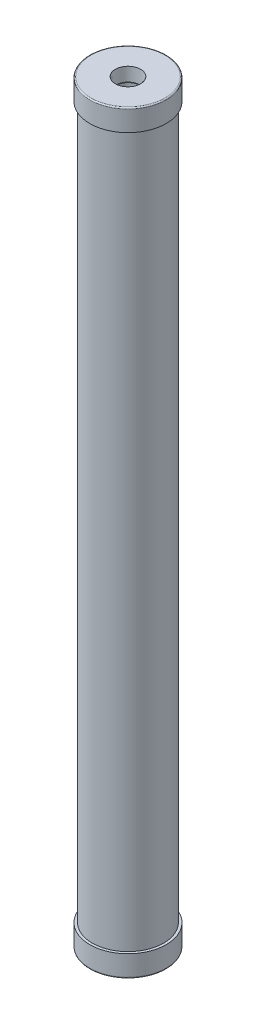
SolidWorks part; units mm, degrees
ref_plane "Front Plane" through (0, 0, 0) normal (0, 0, 1) x (1, 0, 0)
ref_plane "Top Plane" through (0, 0, 0) normal (0, 1, 0) x (1, 0, 0)
ref_plane "Right Plane" through (0, 0, 0) normal (1, 0, 0) x (0, 0, -1)
sketch "Sketch1" plane through (0, 0, 0) normal (0, 1, 0) x (1, 0, 0)
  circle A0 centre (0, 0) radius 44.45
  circle A1 centre (0, 0) radius 38.6334
  dimension "D1" = 88.9
  dimension "D2" = 5.8166
extrude "Boss-Extrude1" add sketch "Sketch1" along normal blind 939.8
ref_plane "Plane1" through (0, 939.8, 0) normal (0, 1, 0) x (1, 0, 0)
sketch "Sketch2" plane through (0, 0, 0) normal (0, 1, 0) x (1, 0, 0)
  circle A0 centre (0, 0) radius 47.625
  dimension "D1" = 95.25
extrude "Boss-Extrude2" add sketch "Sketch2" along normal blind 26.924
hole_wizard "1 NPT Tapped Hole1" positions "Sketch4" profile "Sketch3" size "1" standard "ANSI Inch"
sketch "Sketch4" plane through (0, 0, 0) normal (0, 1, 0) x (1, 0, 0)
  point P0 (0, 0)
sketch "Sketch3" plane through (0, 0, 0) normal (1, 0, 0) x (0, 0, -1)
  line L0 (0, 0) -> (0, 36.6469)
  line L1 (14.4907, 27.94) -> (0, 36.6469)
  line L2 (-14.4907, 27.94) -> (0, 36.6469) construction
  line L3 (14.4907, 27.94) -> (14.4907, 16.764)
  line L4 (14.4907, 16.764) -> (15.228, 16.764)
  line L5 (15.228, 16.764) -> (15.7299, 0)
  line L6 (-15.228, 16.764) -> (-15.7299, 0) construction
  line L7 (15.7299, 0) -> (0, 0)
  line L8 (0, -6.35) -> (0, 107.95) construction
  line L11 (-14.4907, 16.764) -> (-15.228, 16.764) construction
  dimension "Tap Drill Dia." = 28.9814
  dimension "Tap Drill Depth" = 27.94
  dimension "Thread Dia." = 31.4598
  dimension "Thread Angle" = 3.43
  dimension "Thread Depth" = 16.764
  dimension "Drill Angle" = 118
sketch "Sketch5" plane through (0, 939.8, 0) normal (0, 1, 0) x (1, 0, 0)
  circle A0 centre (0, 0) radius 47.625
  dimension "D1" = 95.25
extrude "Boss-Extrude3" add sketch "Sketch5" against normal blind 26.924
hole_wizard "1 NPT Tapped Hole2" positions "Sketch7" profile "Sketch6" size "1" standard "ANSI Inch"
sketch "Sketch7" plane through (0, 939.8, 0) normal (0, 1, 0) x (1, 0, 0)
  point P0 (0, 0)
sketch "Sketch6" plane through (0, 939.8, 0) normal (1, 0, 0) x (0, 0, 1)
  line L0 (0, 0) -> (0, 36.6469)
  line L1 (14.4907, 27.94) -> (0, 36.6469)
  line L2 (-14.4907, 27.94) -> (0, 36.6469) construction
  line L3 (14.4907, 27.94) -> (14.4907, 16.764)
  line L4 (14.4907, 16.764) -> (15.228, 16.764)
  line L5 (15.228, 16.764) -> (15.7299, 0)
  line L6 (-15.228, 16.764) -> (-15.7299, 0) construction
  line L7 (15.7299, 0) -> (0, 0)
  line L8 (0, -6.35) -> (0, 107.95) construction
  line L11 (-14.4907, 16.764) -> (-15.228, 16.764) construction
  dimension "Tap Drill Dia." = 28.9814
  dimension "Tap Drill Depth" = 27.94
  dimension "Thread Dia." = 31.4598
  dimension "Thread Angle" = 3.43
  dimension "Thread Depth" = 16.764
  dimension "Drill Angle" = 118
fillet "Fillet1" radius 1.524 2 edges at (0, 0, 47.625) (0, 939.8, 47.625)
